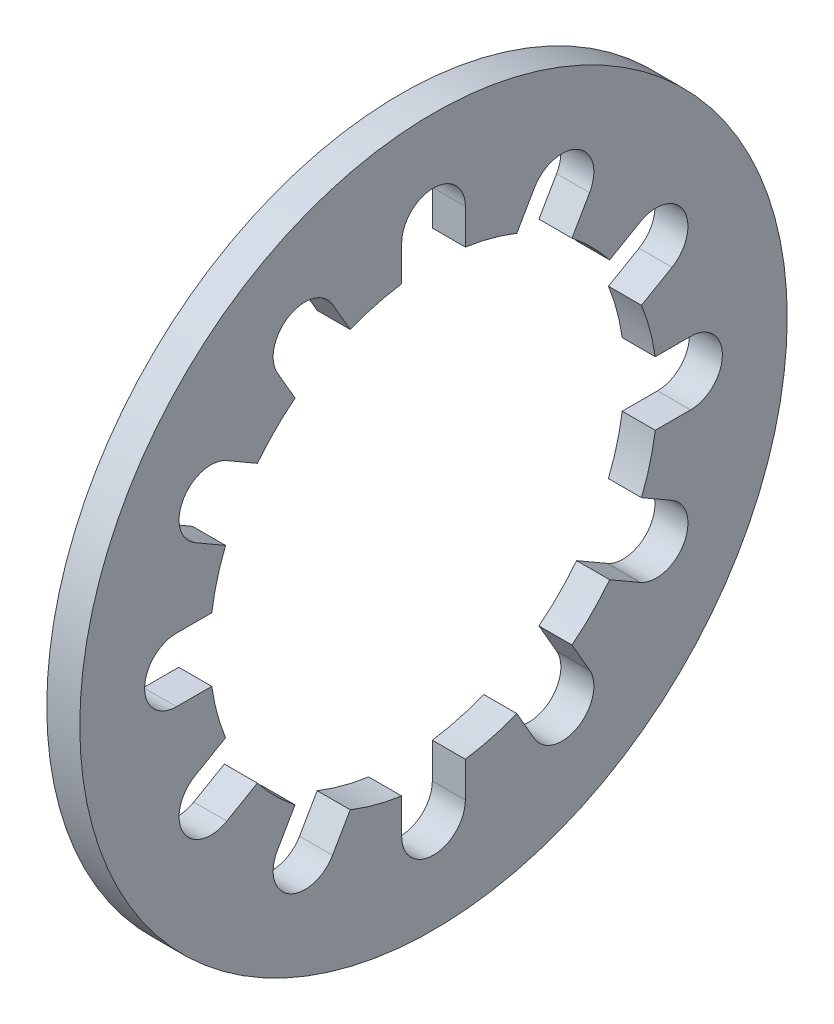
SolidWorks part; units mm, degrees
ref_plane "Plane1" through (0, 0, 0) normal (0, 0, 1) x (1, 0, 0)
ref_plane "Plane2" through (0, 0, 0) normal (0, 1, 0) x (1, 0, 0)
ref_plane "Plane3" through (0, 0, 0) normal (1, 0, 0) x (0, 0, -1)
sketch "Sketch1" plane through (0, 0, 0) normal (1, 0, 0) x (0, 0, -1)
  circle A0 centre (0, 0) radius 9.5
  circle A1 centre (0, 0) radius 15
  dimension "InsideDia" = 19
  dimension "OutsideDia" = 30
extrude "Base-Extrude" add sketch "Sketch1" against normal blind 1.4
sketch "Sketch3" plane through (0, 0, 0) normal (1, 0, 0) x (0, 0, -1)
  line L0 (1.1742, 12.9339) -> (2.25, 14.8303)
  line L1 (-1.1742, 12.9339) -> (-2.25, 14.8303)
  line L2 (-2.25, 14.8303) -> (-2.25, 16.1803)
  line L3 (-2.25, 16.1803) -> (2.25, 16.1803)
  line L4 (2.25, 16.1803) -> (2.25, 14.8303)
  arc A0 (-1.1742, 12.9339) -> (1.1742, 12.9339) centre (0, 13.6) ccw
  circle A1 centre (0, 0) radius 15 construction
  circle A2 centre (0, 0) radius 12.25 construction
  dimension "D1" = 2.7
  dimension "D4" = 24.5
  dimension "D2" = 4.5
  dimension "D3" = 1.35
  dimension "D5" = 2.25
extrude "TypeASlot" [suppressed] cut sketch "Sketch3" against normal through all
pattern_circular "TypeAPattern" [suppressed] count 12 over 360
sketch "Sketch2" plane through (0, 0, 0) normal (1, 0, 0) x (0, 0, -1)
  line L0 (1.35, 0) -> (1.35, 10.9)
  line L1 (-1.35, 10.9) -> (-1.35, 0)
  line L2 (-1.35, 0) -> (1.35, 0)
  arc A0 (1.35, 10.9) -> (-1.35, 10.9) centre (0, 10.9) ccw
  circle A3 centre (0, 0) radius 12.25 construction
  dimension "D1" = 24.5
  dimension "SlotWidth" = 2.7
extrude "TypeJSlot" cut sketch "Sketch2" against normal through all
pattern_circular "TypeJPattern" count 12 over 360 about axis through (0, 0, 0) along (1, 0, 0) of "TypeJSlot"
equation "\"SlotWidth@Sketch2\" = \"OutsideDia@Sketch1\" * .09"
equation "\"D1@Sketch2\" = \"InsideDia@Sketch1\" +  ( \"OutsideDia@Sketch1\" - \"InsideDia@Sketch1\" )  / 2"
equation "\"D1@Sketch3\" = \"OutsideDia@Sketch1\" * .09"
equation "\"D2@Sketch3\" = \"OutsideDia@Sketch1\" * .15"
equation "\"D3@Sketch3\" = \"D1@Sketch3\" / 2"
equation "\"D4@Sketch3\" = \"InsideDia@Sketch1\" +  ( \"OutsideDia@Sketch1\" - \"InsideDia@Sketch1\" )  / 2"
equation "\"D5@Sketch3\" = \"D2@Sketch3\" / 2"
